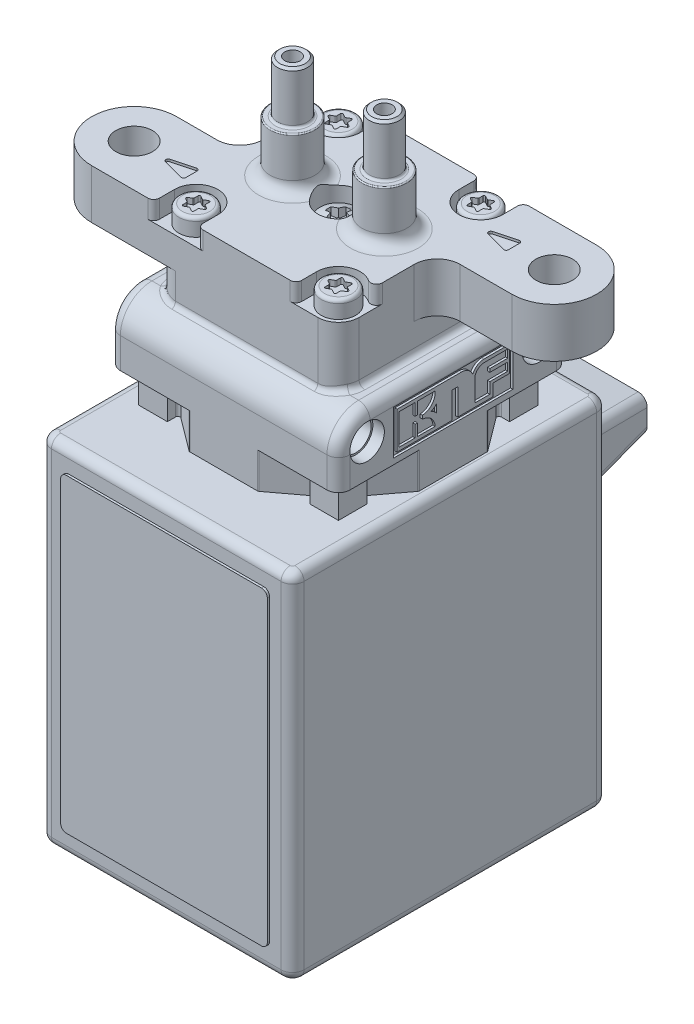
SolidWorks part; units mm, degrees
ref_plane "Front Plane" through (0, 0, 0) normal (0, 0, 1) x (1, 0, 0)
ref_plane "Top Plane" through (0, 0, 0) normal (0, 1, 0) x (1, 0, 0)
ref_plane "Right Plane" through (0, 0, 0) normal (1, 0, 0) x (0, 0, -1)
imported_body "Imported1"
imported_body "Imported2"
imported_body "Imported3"
imported_body "Imported4"
sketch "Sketch1" plane through (0, -15.1, 0) normal (0, -1, 0) x (1, 0, 0)
  line L0 (3.6119, -22.5) -> (4.4, -22.5) construction
  line L1 (-5.8651, -22.5) -> (4.347, -22.5)
  line L2 (-5.8651, -22.5) -> (-5.8651, -33.339)
  line L3 (-5.8651, -33.339) -> (4.347, -33.339)
  line L4 (4.347, -22.5) -> (4.347, -33.339)
extrude "Cut-Extrude1" cut sketch "Sketch1" against normal through all
